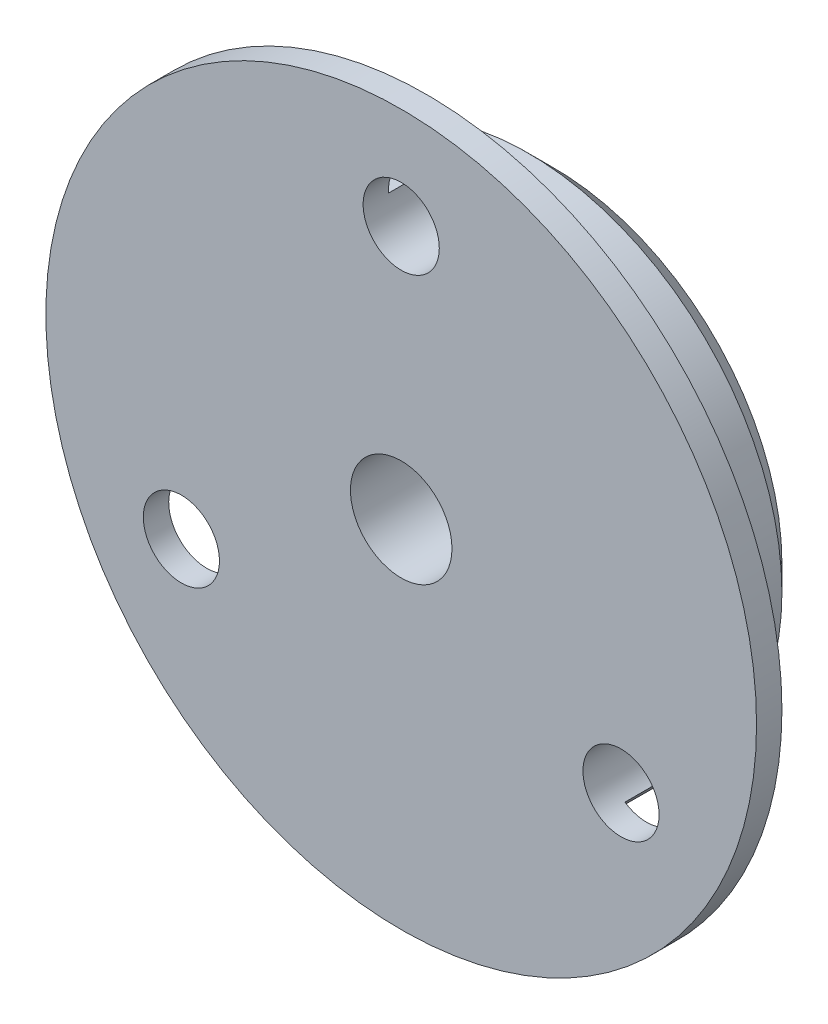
SolidWorks part; units mm, degrees
ref_plane "Plan de face" through (0, 0, 0) normal (0, 0, 1) x (1, 0, 0)
ref_plane "Plan de dessus" through (0, 0, 0) normal (0, 1, 0) x (1, 0, 0)
ref_plane "Plan de droite" through (0, 0, 0) normal (1, 0, 0) x (0, 0, -1)
sketch "Esquisse1" plane through (0, 0, 0) normal (0, 0, 1) x (1, 0, 0)
  circle A0 centre (0, 0) radius 10
extrude "Extrusion1" add sketch "Esquisse1" along normal blind 5
chamfer "Chanfrein1" distance 1 angle 45 1 edges at (10, 0, 0)
sketch "Esquisse2" plane through (0, 0, 5) normal (0, 0, 1) x (1, 0, 0)
  circle A0 centre (0, 0) radius 14
  dimension "D1" = 28
extrude "Extrusion2" add sketch "Esquisse2" along normal blind 1
sketch "Esquisse3" plane through (0, 0, 6) normal (0, 0, 1) x (1, 0, 0)
  circle A0 centre (0, 0) radius 2
  dimension "D1" = 4
extrude "Enlèv. mat.-Extru.1" cut sketch "Esquisse3" against normal through all
sketch "Esquisse4" plane through (0, 0, 6) normal (0, 0, 1) x (1, 0, 0)
  circle A0 centre (0, 10) radius 1.5
  circle A1 centre (8.6603, -5) radius 1.5
  circle A2 centre (-8.6603, -5) radius 1.5
  dimension "D1" = 10
extrude "Enlèv. mat.-Extru.2" cut sketch "Esquisse4" against normal blind 3
